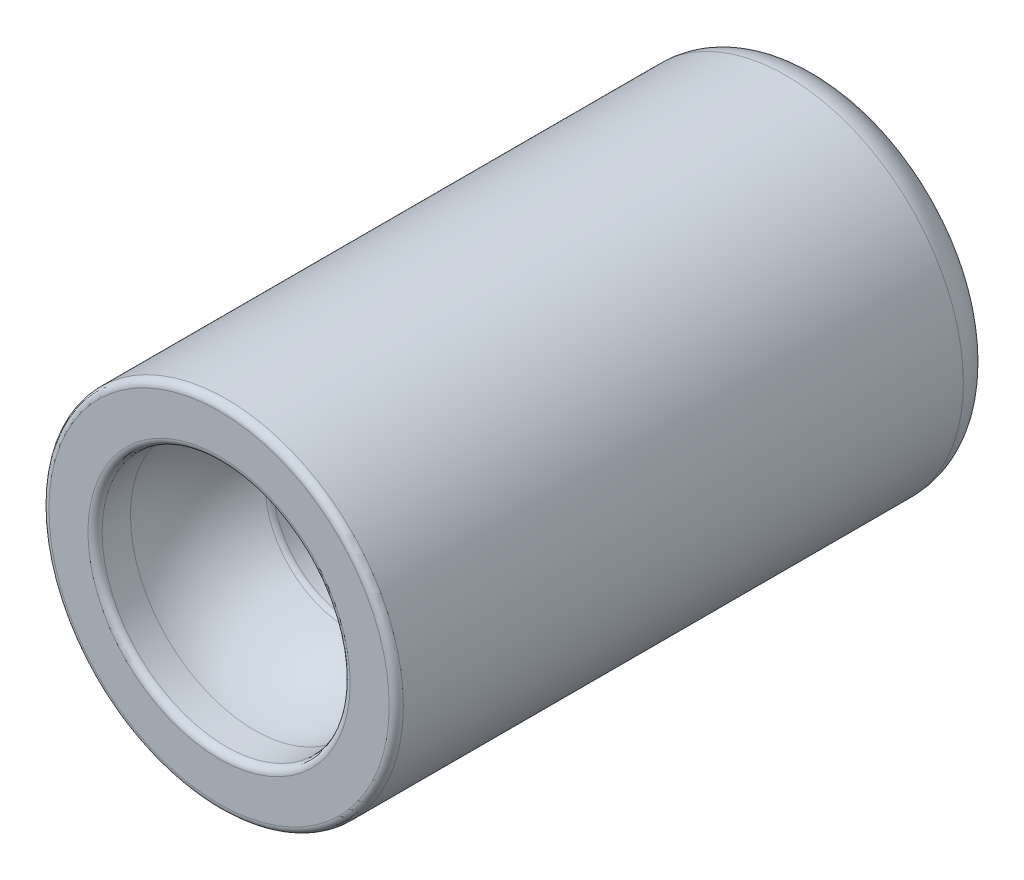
SolidWorks part; units mm, degrees
ref_plane "Plan de face" through (0, 0, 0) normal (0, 0, 1) x (1, 0, 0)
ref_plane "Plan de dessus" through (0, 0, 0) normal (0, 1, 0) x (1, 0, 0)
ref_plane "Plan de droite" through (0, 0, 0) normal (1, 0, 0) x (0, 0, -1)
sketch "Esquisse1" plane through (0, 0, 0) normal (1, 0, 0) x (0, 0, -1)
  line L0 (0, 0) -> (53.286, 0) construction
  line L1 (0, 5) -> (16, 5)
  line L2 (17, 4) -> (17, 3.5)
  line L3 (17, 3.5) -> (12.5, 3.5)
  line L4 (3.681, 2.25) -> (9.819, 2.25)
  line L5 (0, 5) -> (0, 3.5)
  line L6 (1, 3.5) -> (0, 3.5)
  arc A0 (3.681, 2.25) -> (1, 3.5) centre (1, 0) ccw
  arc A1 (12.5, 3.5) -> (9.819, 2.25) centre (12.5, 0) ccw
  arc A2 (16, 5) -> (17, 4) centre (16, 4) cw
  point P16 (17, 5)
  dimension "D2" = 7
  dimension "D5" = 1
  dimension "D6" = 3.5
  dimension "D8" = 1
  dimension "D1" = 10
  dimension "D3" = 4.5
  dimension "D4" = 17
  dimension "D7" = 11.5
revolve "Révolution1" add sketch "Esquisse1" angle 360 about L0
fillet "Congé1" radius 0.2 5 edges at (2.25, 0, -9.819) (3.5, 0, -17) (5, 0, 0) (3.5, 0, 0) (2.25, 0, -3.681)
